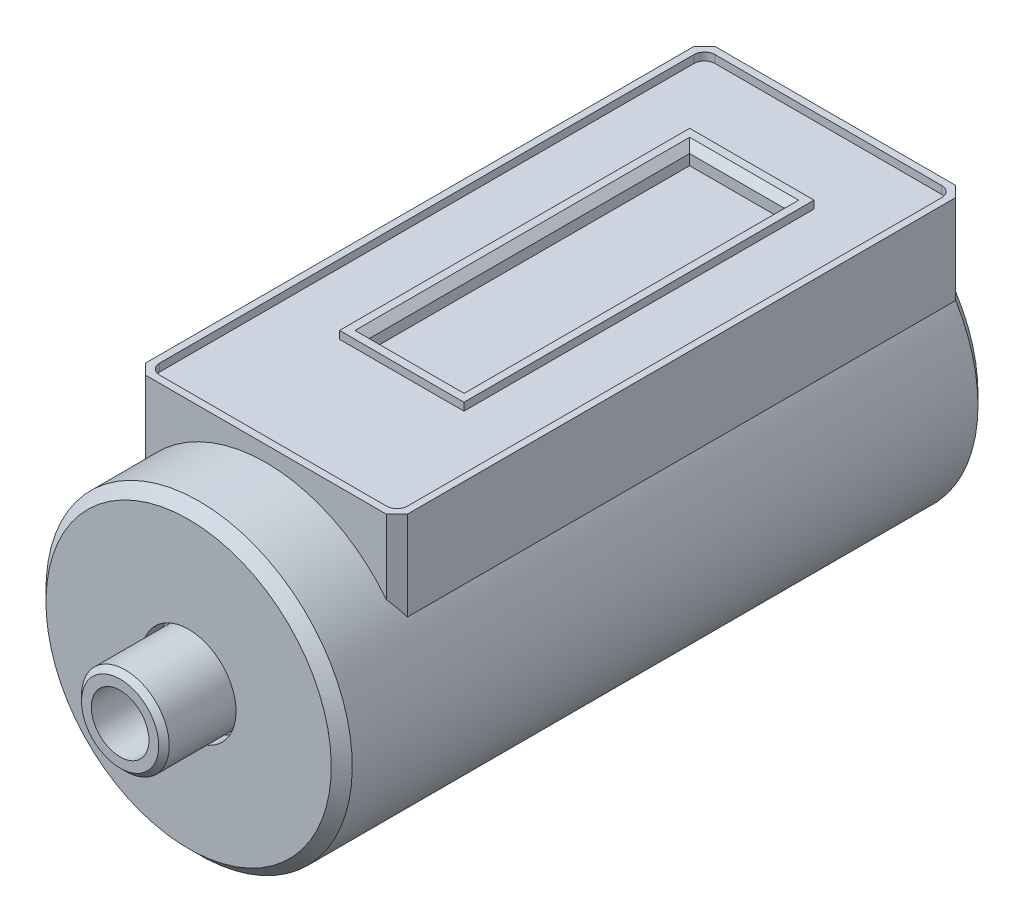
SolidWorks part; units mm, degrees
ref_plane "Front" through (0, 0, 0) normal (0, 0, 1) x (1, 0, 0)
ref_plane "Top" through (0, 0, 0) normal (0, 1, 0) x (1, 0, 0)
ref_plane "Right" through (0, 0, 0) normal (1, 0, 0) x (0, 0, -1)
sketch "Sketch2" plane through (0, 0, 0) normal (1, 0, 0) x (0, 0, -1)
  line L0 (44.31, 0) -> (44.31, 2.79)
  line L1 (44.69, 3.17) -> (50.53, 3.17)
  line L2 (49.26, 3.43) -> (49.26, 10.31)
  line L3 (50.02, 11.07) -> (96, 11.07)
  line L4 (96, 11.07) -> (96, 0)
  line L5 (96, 0) -> (44.31, 0)
  line L6 (49.26, 3.43) -> (50.53, 3.43)
  line L7 (50.53, 3.43) -> (50.53, 3.17)
  line L8 (44.31, 2.79) -> (44.69, 3.17)
  line L9 (49.26, 10.31) -> (50.02, 11.07)
  dimension "D1" = 51.69
  dimension "D2" = 3.17
  dimension "D3" = 11.07
  dimension "D4" = 4.95
  dimension "D5" = 1.27
  dimension "D6" = 3.43
  dimension "D7" = 2.79
  dimension "D8" = 0.38
  dimension "D9" = 0.76
  dimension "D10" = 10.31
  dimension "D11" = 96
revolve "Revolve1" add sketch "Sketch2" angle 360 about L5
sketch "Sketch3" plane through (0, 0, 0) normal (0, 1, 0) x (1, 0, 0)
  line L0 (11.07, 96) -> (-11.07, 96) construction
  line L1 (-9.46, 96) -> (9.46, 96)
  line L2 (-9.46, 96) -> (-9.46, 55.61)
  line L3 (-8.7, 54.85) -> (8.7, 54.85)
  line L4 (9.46, 96) -> (9.46, 55.61)
  line L5 (-9.46, 55.61) -> (-8.7, 54.85)
  line L6 (9.46, 55.61) -> (8.7, 54.85)
  point P1 (9.46, 54.85)
  point P2 (-9.46, 54.85)
  point P6 (0, 54.85)
  dimension "D1" = 41.15
  dimension "D2" = 18.92
extrude "Extrude1" add sketch "Sketch3" along normal blind 12.19
chamfer "Chamfer1" distance 0.76 angle 45 3 edges at (-9.46, 8.9696, -96) (0, -11.07, -96) (9.46, 8.9696, -96)
sketch "Sketch4" plane through (0, 12.19, 0) normal (0, 1, 0) x (1, 0, 0)
  line L0 (-8.7, 54.85) -> (8.7, 54.85) construction
  line L1 (-8.19, 95.49) -> (8.2, 95.49)
  line L2 (-8.95, 94.73) -> (-8.95, 56.12)
  line L3 (-8.19, 55.36) -> (8.2, 55.36)
  line L4 (8.96, 94.73) -> (8.96, 56.12)
  line L5 (-9.46, 55.61) -> (-9.46, 95.24) construction
  line L7 (-4.49, 89.96) -> (4.5, 89.96)
  line L8 (-4.49, 89.96) -> (-4.49, 64.66)
  line L9 (-4.49, 64.66) -> (4.5, 64.66)
  line L10 (4.5, 89.96) -> (4.5, 64.66)
  arc A0 (-8.95, 94.73) -> (-8.19, 95.49) centre (-8.19, 94.73) cw
  arc A1 (8.96, 94.73) -> (8.2, 95.49) centre (8.2, 94.73) ccw
  arc A2 (8.96, 56.12) -> (8.2, 55.36) centre (8.2, 56.12) cw
  arc A3 (-8.95, 56.12) -> (-8.19, 55.36) centre (-8.19, 56.12) ccw
  dimension "D5" = 0.76
  dimension "D1" = 17.91
  dimension "D2" = 40.13
  dimension "D3" = 0.51
  dimension "D4" = 0.51
  dimension "D6" = 5.53
  dimension "D7" = 4.46
  dimension "D8" = 4.46
  dimension "D9" = 25.3
extrude "Cut-Extrude1" cut sketch "Sketch4" against normal blind 0.56
sketch "Sketch5" plane through (0, 12.19, 0) normal (0, 1, 0) x (1, 0, 0)
  line L1 (-3.42, 88.89) -> (3.44, 88.89)
  line L2 (-3.42, 88.89) -> (-3.42, 65.73)
  line L3 (-3.42, 65.73) -> (3.44, 65.73)
  line L4 (3.44, 88.89) -> (3.44, 65.73)
  line L6 (4.5, 89.96) -> (-4.49, 89.96) construction
  line L7 (-4.49, 89.96) -> (-4.49, 64.66) construction
  point P4 (0.005, 89.96)
  dimension "D1" = 6.86
  dimension "D2" = 23.16
  dimension "D3" = 1.07
  dimension "D4" = 1.07
extrude "Cut-Extrude2" cut sketch "Sketch5" against normal blind 1.27
chamfer "Chamfer2" distance 0.51 angle 45 4 edges at (0.01, 12.19, -65.73) (3.44, 12.19, -77.31) (-3.42, 12.19, -77.31) (0.01, 12.19, -88.89)
hole_wizard "Hole1" positions "Sketch7" profile "Sketch6" legacy
sketch "Sketch7" plane through (0, 0, -44.31) normal (0, 0, 1) x (1, 0, 0)
  circle A0 centre (0, 0) radius 3.17 construction
  point P0 (0, 0)
sketch "Sketch6" plane through (0, 0, -44.31) normal (1, 0, 0) x (0, -1, 0)
  line L0 (0, 0) -> (0, 7.6015)
  line L1 (0, 7.6015) -> (2.0828, 6.35)
  line L2 (2.0828, 6.35) -> (2.0828, 0)
  line L4 (2.0828, 0) -> (0, 0)
  line L6 (0, 7.6015) -> (-2.0828, 6.35) construction
  line L7 (0, -4.2442) -> (0, 117.3081) construction
  dimension "Diameter" = 4.1656
  dimension "Depth" = 6.35
  dimension "Drill Angle" = 118
